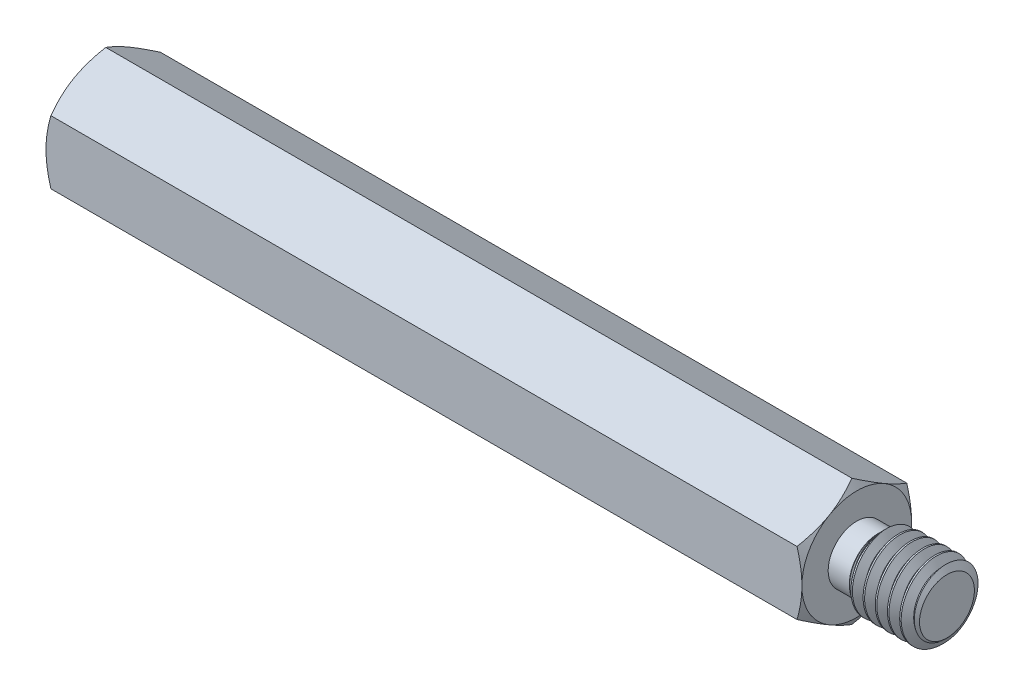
SolidWorks part; units mm, degrees
other "<STANDOFF-M3X0.5-31-MF>-<Cut-Revolve2>"
ref_plane "Front Plane" through (0, 0, 0) normal (0, 0, 1) x (1, 0, 0)
ref_plane "Top Plane" through (0, 0, 0) normal (0, 1, 0) x (1, 0, 0)
ref_plane "Right Plane" through (0, 0, 0) normal (1, 0, 0) x (0, 0, -1)
inserted part "STANDOFF-M3X0.5-31-MF"
